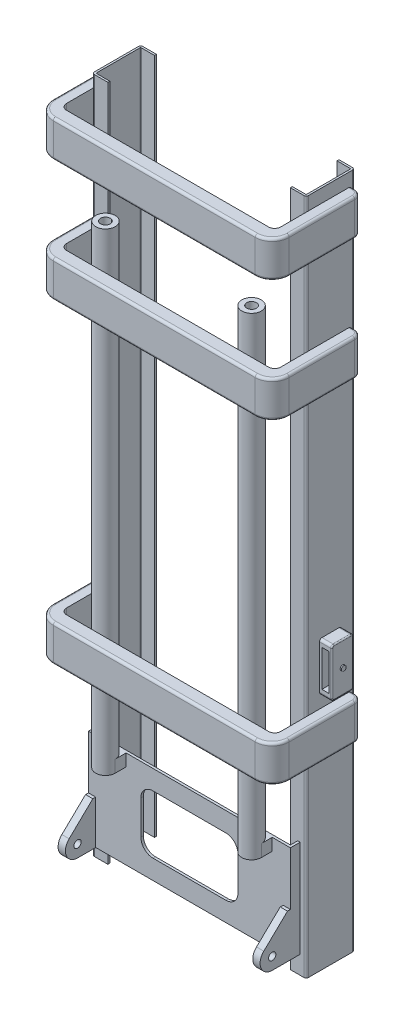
SolidWorks part; units mm, degrees
ref_plane "Front Plane" through (0, 0, 0) normal (0, 0, 1) x (1, 0, 0)
ref_plane "Top Plane" through (0, 0, 0) normal (0, 1, 0) x (1, 0, 0)
ref_plane "Right Plane" through (0, 0, 0) normal (1, 0, 0) x (0, 0, -1)
sketch "Sketch2" plane through (0, 0, 0) normal (0, 1, 0) x (1, 0, 0)
  line L0 (0, 10) -> (0, 190)
  line L1 (10, 200) -> (65, 200)
  line L2 (10, 0) -> (65, 0)
  line L3 (10, 8) -> (65, 8)
  line L4 (8, 10) -> (8, 190)
  line L5 (10, 192) -> (65, 192)
  line L6 (65, 192) -> (65, 200)
  line L7 (65, 8) -> (65, 0)
  line L8 (8, 100) -> (441, 100) construction
  line L9 (441, 100) -> (441, -133.9276) construction
  line L10 (817, 8) -> (817, 0)
  line L11 (817, 192) -> (817, 200)
  line L12 (872, 192) -> (817, 192)
  line L13 (874, 10) -> (874, 190)
  line L14 (872, 8) -> (817, 8)
  line L15 (872, 0) -> (817, 0)
  line L16 (872, 200) -> (817, 200)
  line L17 (882, 10) -> (882, 190)
  arc A0 (0, 10) -> (10, 0) centre (10, 10) ccw
  arc A1 (0, 190) -> (10, 200) centre (10, 190) cw
  arc A2 (8, 10) -> (10, 8) centre (10, 10) ccw
  arc A3 (8, 190) -> (10, 192) centre (10, 190) cw
  arc A4 (874, 190) -> (872, 192) centre (872, 190) ccw
  arc A5 (874, 10) -> (872, 8) centre (872, 10) cw
  arc A6 (882, 190) -> (872, 200) centre (872, 190) ccw
  arc A7 (882, 10) -> (872, 0) centre (872, 10) cw
  point P7 (0, 0)
  point P10 (0, 200)
  point P29 (882, 200)
  point P32 (882, 0)
  dimension "D4" = 10
  dimension "D1" = 200
  dimension "D2" = 65
  dimension "D3" = 65
  dimension "D6" = 441
  dimension "D5" = 8
extrude "Boss-Extrude1" add sketch "Sketch2" along normal blind 2790
sketch "Sketch4" plane through (0, 0, 0) normal (0, 1, 0) x (1, 0, 0)
  line L0 (25, 0) -> (25, -40)
  line L1 (10, 0) -> (65, 0) construction
  line L2 (25, -40) -> (857, -40)
  line L3 (857, -40) -> (857, 0)
  line L4 (0, 190) -> (0, 10) construction
  line L5 (882, 10) -> (882, 190) construction
  line L6 (35, 0) -> (35, -30)
  line L7 (35, -30) -> (847, -30)
  line L8 (847, -30) -> (847, 0)
  line L9 (25, 0) -> (35, 0)
  line L10 (847, 0) -> (857, 0)
  dimension "D1" = 40
  dimension "D2" = 25
  dimension "D3" = 25
  dimension "D4" = 10
extrude "Boss-Extrude2" add sketch "Sketch4" along normal blind 400 from offset 75
sketch "Sketch6" plane through (0, 0, 0) normal (1, 0, 0) x (0, 0, -1)
  line L0 (-40, 75) -> (-115, 75)
  line L1 (-149.6667, 161.0308) -> (-52, 255)
  line L2 (-52, 255) -> (-40, 255)
  line L3 (-40, 475) -> (-40, 75) construction
  line L4 (-40, 255) -> (-40, 75)
  arc A0 (-115, 75) -> (-149.6667, 161.0308) centre (-115, 125) cw
  circle A1 centre (-115, 125) radius 15
  dimension "D3" = 50
  dimension "D4" = 30
  dimension "D1" = 180
  dimension "D2" = 12
  dimension "D5" = 75
extrude "Boss-Extrude3" add sketch "Sketch6" along normal blind 30 from offset 25
ref_plane "Plane1" through (441, 0, 0) normal (-1, 0, 0) x (0, 0, 1)
mirror "Mirror1" about plane through (441, 0, 0) normal (-1, 0, 0) of "Boss-Extrude3"
sketch "Sketch7" plane through (0, 0, 0) normal (0, 1, 0) x (1, 0, 0)
  line L0 (0, 185) -> (-15, 185)
  line L1 (0, 190) -> (0, 10) construction
  line L2 (-45, 155) -> (-45, -115)
  line L3 (25, -185) -> (857, -185)
  line L4 (927, -115) -> (927, 155)
  line L5 (897, 185) -> (882, 185)
  line L6 (882, 10) -> (882, 190) construction
  line L7 (65, 200) -> (10, 200) construction
  line L8 (872, 200) -> (817, 200) construction
  line L9 (0, 185) -> (0, -105)
  line L10 (25, -130) -> (857, -130)
  line L11 (882, -105) -> (882, 185)
  arc A0 (857, -185) -> (927, -115) centre (857, -115) ccw
  arc A1 (-45, -115) -> (25, -185) centre (25, -115) ccw
  arc A2 (927, 155) -> (897, 185) centre (897, 155) ccw
  arc A3 (-15, 185) -> (-45, 155) centre (-15, 155) ccw
  arc A4 (857, -130) -> (882, -105) centre (857, -105) ccw
  arc A5 (0, -105) -> (25, -130) centre (25, -105) ccw
  point P18 (-45, -185)
  point P23 (-45, 185)
  dimension "D5" = 70
  dimension "D6" = 30
  dimension "D7" = 25
  dimension "D1" = 45
  dimension "D2" = 15
  dimension "D3" = 15
  dimension "D4" = 370
  dimension "D8" = 55
extrude "Boss-Extrude4" add sketch "Sketch7" along normal blind 150 from offset 785
fillet "Fillet1" radius 10 18 edges at (-7.5, 935, -185) (-36.2132, 935, -176.2132) (889.5, 935, -185) (918.2132, 935, -176.2132) (927, 935, -20) (906.4975, 935, 164.4975) (441, 935, 185) (-24.4975, 935, 164.4975) (-7.5, 785, -185) (-36.2132, 785, -176.2132) (889.5, 785, -185) (918.2132, 785, -176.2132) (927, 785, -20) (906.4975, 785, 164.4975) (441, 785, 185) (-24.4975, 785, 164.4975) (-45, 935, -20) (-45, 785, -20)
pattern_linear "LPattern2" count 2 spacing 1800 along (0, 1, 0) of "Fillet1", "Boss-Extrude4"
pattern_linear "LPattern20" count 2 spacing 1300 along (0, 1, 0) of "Fillet1", "Boss-Extrude4"
sketch "Sketch8" plane through (0, 0, 40) normal (0, 0, 1) x (1, 0, 0)
  line L0 (441, 395) -> (441, 475) construction
  line L1 (291, 395) -> (591, 395)
  line L2 (241, 345) -> (241, 205)
  line L3 (291, 155) -> (591, 155)
  line L4 (641, 345) -> (641, 205)
  line L5 (25, 475) -> (857, 475) construction
  line L6 (441, 99) -> (441, -99) construction
  line L7 (441, 155) -> (441, 75) construction
  line L8 (55, 75) -> (827, 75) construction
  arc A0 (241, 205) -> (291, 155) centre (291, 205) ccw
  arc A1 (591, 155) -> (641, 205) centre (591, 205) ccw
  arc A2 (591, 395) -> (641, 345) centre (591, 345) cw
  arc A3 (291, 395) -> (241, 345) centre (291, 345) ccw
  point P20 (641, 395)
  point P23 (241, 395)
  dimension "D3" = 50
  dimension "D1" = 80
  dimension "D2" = 400
extrude "Cut-Extrude1" cut sketch "Sketch8" against normal up to next
sketch "Sketch9" plane through (0, 475, 0) normal (0, 1, 0) x (1, 0, 0)
  line L0 (782, -85) -> (782, -40)
  line L1 (55, -40) -> (827, -40) construction
  line L2 (782, -40) -> (702, -40)
  line L3 (702, -40) -> (702, -85)
  line L4 (882, 10) -> (882, 190) construction
  line L5 (441, -40) -> (441, 39.495) construction
  line L6 (441, 99) -> (441, -99) construction
  line L7 (100, -40) -> (180, -40)
  line L8 (100, -85) -> (100, -40)
  line L9 (180, -40) -> (180, -85)
  arc A0 (702, -85) -> (782, -85) centre (742, -85) ccw
  arc A1 (180, -85) -> (100, -85) centre (140, -85) cw
  dimension "D1" = 40
  dimension "D2" = 45
  dimension "D3" = 100
extrude "Boss-Extrude5" add sketch "Sketch9" against normal blind 50
sketch "Sketch10" plane through (0, 475, 0) normal (0, 1, 0) x (1, 0, 0)
  circle A0 centre (140, -85) radius 40
  circle A1 centre (742, -85) radius 40
  circle A2 centre (140, -85) radius 20
  circle A3 centre (742, -85) radius 20
  dimension "D1" = 40
extrude "Boss-Extrude6" add sketch "Sketch10" along normal blind 1900
sketch "Sketch11" plane through (0, 0, 0) normal (-1, 0, 0) x (0, 0, 1)
  line L0 (-100, 985) -> (-100, 0) construction
  line L1 (-135, 1185) -> (-65, 1185)
  line L2 (-145, 1175) -> (-145, 995)
  line L3 (-135, 985) -> (-65, 985)
  line L4 (-55, 1175) -> (-55, 995)
  line L5 (-190, 0) -> (-10, 0) construction
  arc A0 (-65, 985) -> (-55, 995) centre (-65, 995) ccw
  arc A1 (-145, 995) -> (-135, 985) centre (-135, 995) ccw
  arc A2 (-65, 1185) -> (-55, 1175) centre (-65, 1175) cw
  arc A3 (-135, 1185) -> (-145, 1175) centre (-135, 1175) ccw
  point P12 (-145, 985)
  point P15 (-55, 1185)
  point P18 (-145, 1185)
  dimension "D4" = 10
  dimension "D1" = 90
  dimension "D2" = 200
  dimension "D3" = 985
extrude "Boss-Extrude7" add sketch "Sketch11" along normal blind 50
sketch "Sketch12" plane through (0, 0, -55) normal (0, 0, 1) x (1, 0, 0)
  line L0 (0, 995) -> (0, 1175) construction
  line L1 (-39.5, 1160) -> (-9.5, 1160)
  line L2 (-39.5, 1160) -> (-39.5, 1010)
  line L3 (-39.5, 1010) -> (-9.5, 1010)
  line L4 (-9.5, 1160) -> (-9.5, 1010)
  line L5 (-39.5, 1085) -> (-50, 1085) construction
  line L6 (-50, 995) -> (-50, 1175) construction
  dimension "D1" = 30
  dimension "D2" = 9.5
  dimension "D3" = 150
extrude "Cut-Extrude2" cut sketch "Sketch12" against normal blind 70
sketch "Sketch13" plane through (-50, 0, 0) normal (-1, 0, 0) x (0, 0, 1)
  line L0 (-100, 1185) -> (-100, 985) construction
  line L1 (-65, 1185) -> (-135, 1185) construction
  line L2 (-135, 985) -> (-65, 985) construction
  circle A0 centre (-100, 1085) radius 10
  dimension "D1" = 20
extrude "Boss-Extrude8" add sketch "Sketch13" against normal blind 50 and the other way blind 5
fillet "Fillet2" radius 5 8 edges at (-50, 987.9289, -57.9289) (-50, 985, -100) (-50, 987.9289, -142.0711) (-50, 1085, -145) (-50, 1182.0711, -142.0711) (-50, 1182.0711, -57.9289) (-50, 1085, -55) (-50, 1185, -100)
mirror "Mirror2" about plane through (441, 0, 0) normal (-1, 0, 0) of "Fillet2", "Boss-Extrude7", "Cut-Extrude2", "Boss-Extrude8"
